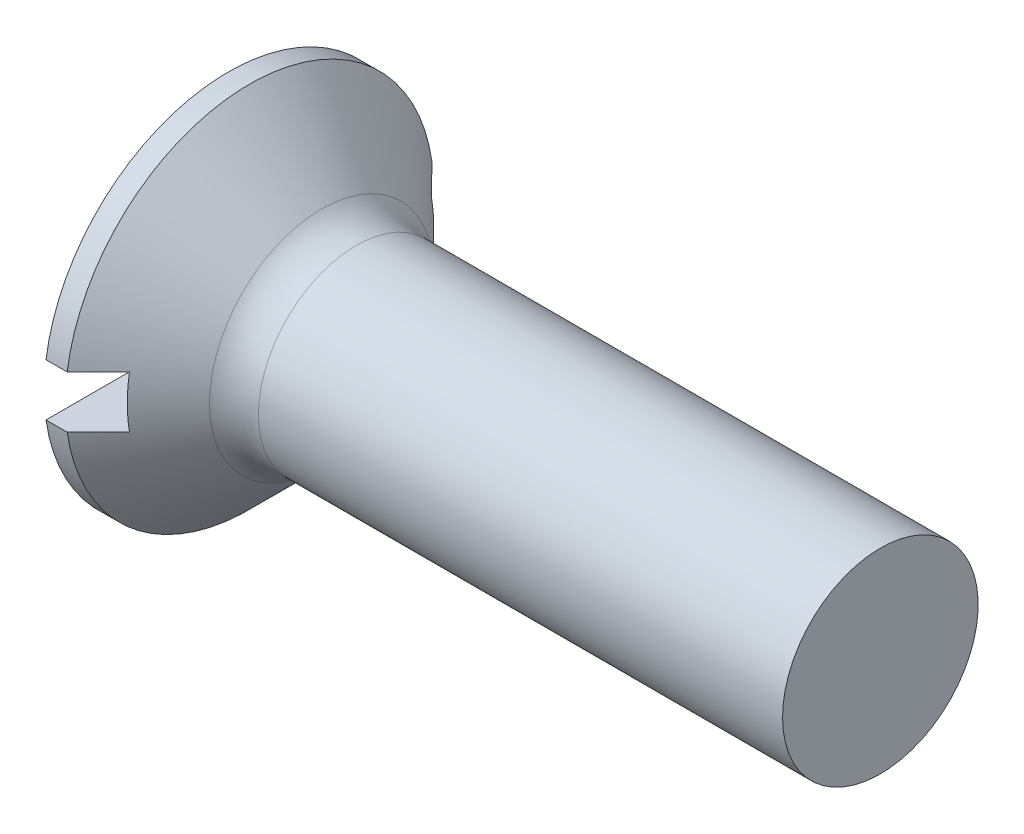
SolidWorks part; units mm, degrees
revolve "Base-Revolve" add sketch "BodySke" angle 360 about L5
sketch "BodySke" plane through (0, 0, 0) normal (0, 0, 1) x (1, 0, 0)
  line L0 (0, 0) -> (0, 5.65)
  line L1 (0, 5.65) -> (0.65, 5.65)
  line L2 (3.3, 3) -> (20, 3)
  line L3 (20, 3) -> (20, 0)
  line L4 (20, 0) -> (0, 0)
  line L5 (-6.35, 0) -> (82.55, 0) construction
  line L6 (3.3, -3) -> (20, -3) construction
  line L7 (0.65, -5.65) -> (3.3, -3) construction
  line L8 (0.65, 5.65) -> (3.3, 3)
  line L9 (0, -5.65) -> (0.65, -5.65) construction
  line L10 (4.3, 4.5875) -> (4.3, -4.9375) construction
  line L11 (0, 6.35) -> (0, -3.175) construction
extrude "Slot" cut sketch "Sketch2" against normal blind 1.6
sketch "Sketch2" plane through (0, 0, 0) normal (-1, 0, 0) x (0, 0, 1)
  line L0 (-5.65, -0.8) -> (5.65, -0.8)
  line L1 (-5.65, -0.8) -> (-5.65, 0.8)
  line L2 (5.65, 0.8) -> (-5.65, 0.8)
  line L3 (5.65, 0.8) -> (5.65, -0.8)
ref_plane "Plane1" through (0, 0, 0) normal (0, 0, 1) x (1, 0, 0)
ref_plane "Plane2" through (0, 0, 0) normal (0, 1, 0) x (1, 0, 0)
ref_plane "Plane3" through (0, 0, 0) normal (1, 0, 0) x (0, 0, -1)
fillet "Fillet1" radius 1.5 1 edges at (3.3, 0, 3)
sketch "ThdSchSke" plane through (0, 0, 0) normal (0, 0, 1) x (1, 0, 0)
  line L0 (4.3, -2.4455) -> (3.9117, -3)
  line L1 (4.3, -2.4455) -> (4.6883, -3)
  line L2 (4.6883, -3) -> (4.6883, -3.75)
  line L3 (-3.175, 0) -> (5.1513, 0) construction
  line L5 (4.6883, -3.75) -> (3.9117, -3.75)
  line L6 (3.9117, -3.75) -> (3.9117, -3)
  line L7 (0, 5.65) -> (0, 0.8) construction
revolve "ThreadSchematic" [suppressed] cut sketch "ThdSchSke" angle 360 about L3
pattern_linear "ThdSchPat" [suppressed]
equation "\"D1@Sketch2\" = \"Slot_width@Sketch2\" / 2"
equation "\"D2@Sketch2\" = \"Head_dia@BodySke\""
equation "\"D3@Sketch2\" = \"D2@Sketch2\" / 2"
equation "\"Thread_length@ThreadCosmetic\" = ((sgn( (\"Length@BodySke\" - \"Advance@BodySke\" * 1.0 - \"Head_ht@BodySke\" ) - \"Thread_nom@BodySke\" )-1)*( (\"Length@BodySke\" - \"Advance@BodySke\" * 1.0 - \"Head_ht@BodySke\" "
equation "\"Thread_minor@ThdSchSke\" = \"Thread_minor@ThreadCosmetic\""
equation "\"Diameter@ThdSchSke\" = \"Diameter@BodySke\""
equation "\"Overcut@ThdSchSke\" = \"Diameter@BodySke\" * 1.25"
equation "\"Start@ThdSchSke\" = 0.000001 + \"Length@BodySke\" - \"Thread_length@ThreadCosmetic\"  '---Countersunk---"
equation "\"Num_threads@ThdSchPat\" = int( \"Thread_length@ThreadCosmetic\" / \"Advance@BodySke\" + 0.999 )  + 1"
equation "\"Advance@ThdSchPat\" = \"Thread_length@ThreadCosmetic\" /  (\"Num_threads@ThdSchPat\" - 1) 'relax it"
